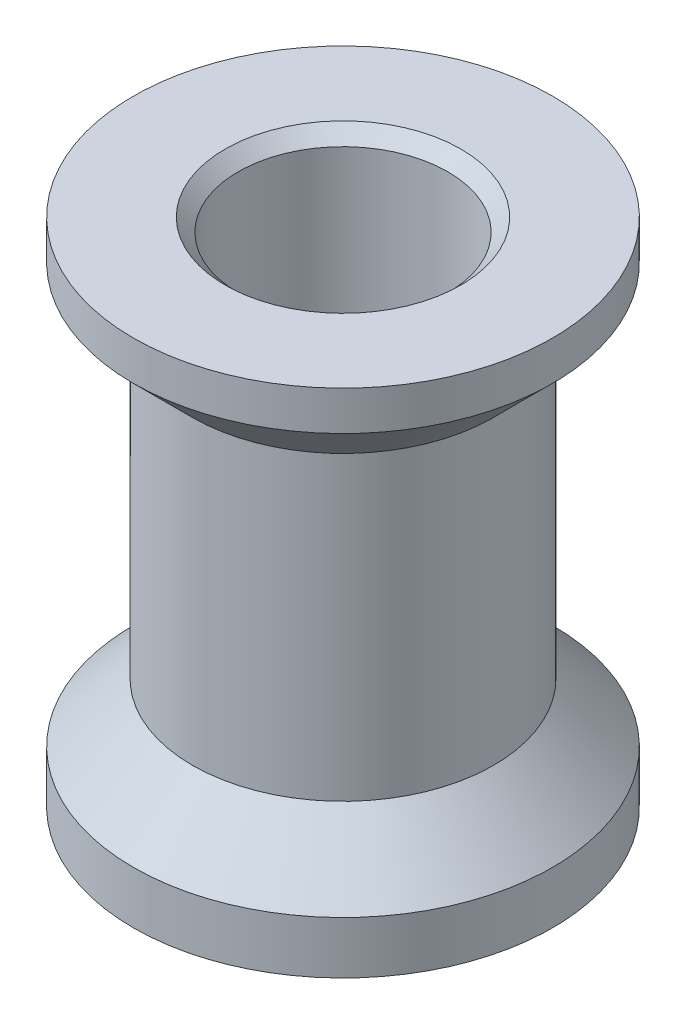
SolidWorks part; units mm, degrees
ref_plane "Спереди" through (0, 0, 0) normal (0, 0, 1) x (1, 0, 0)
ref_plane "Сверху" through (0, 0, 0) normal (0, 1, 0) x (1, 0, 0)
ref_plane "Справа" through (0, 0, 0) normal (1, 0, 0) x (0, 0, -1)
sketch "Эскиз1" plane through (0, 0, 0) normal (1, 0, 0) x (0, 0, -1)
  line L0 (0, 9.75) -> (0, -9.75) construction
  line L1 (4, 9.75) -> (8, 9.75)
  line L2 (8, 9.75) -> (8, 8.25)
  line L3 (8, 8.25) -> (5.75, 6)
  line L4 (5.75, 6) -> (5.75, -5.5)
  line L5 (5.75, -5.5) -> (8, -7.75)
  line L6 (8, -7.75) -> (8, -9.75)
  line L7 (8, -9.75) -> (4, -9.75)
  line L8 (4, -9.75) -> (4, 9.75)
  dimension "D1" = 19.5
  dimension "D2" = 8
  dimension "D3" = 4
  dimension "D4" = 1.5
  dimension "D5" = 2
  dimension "D6" = 5.75
  dimension "D7" = 45
  dimension "D8" = 45
revolve "Повернуть1" add sketch "Эскиз1" angle 360 about L0
chamfer "Фаска1" distance 0.5 angle 45 1 edges at (0, 9.75, 4)
